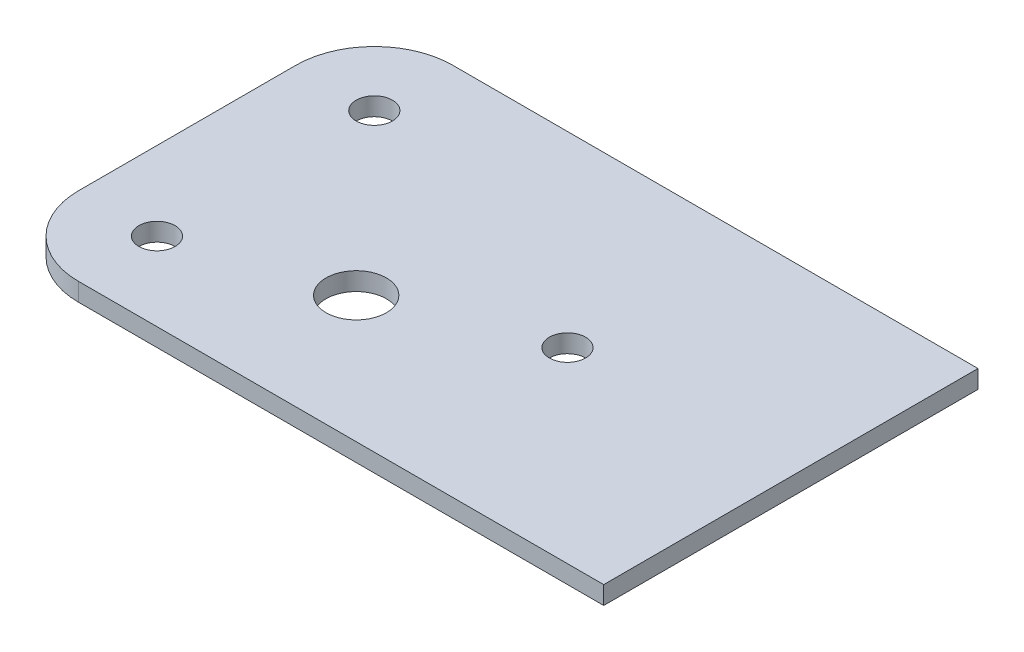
SolidWorks part; units mm, degrees
ref_plane "Front" through (0, 0, 0) normal (0, 0, 1) x (1, 0, 0)
ref_plane "Top" through (0, 0, 0) normal (0, 1, 0) x (1, 0, 0)
ref_plane "Right" through (0, 0, 0) normal (1, 0, 0) x (0, 0, -1)
sketch "Sketch1" plane through (0, 0, 0) normal (0, 1, 0) x (1, 0, 0)
  line L1 (13, 0) -> (100, 0)
  line L2 (0, 13) -> (0, 49)
  line L3 (13, 62) -> (100, 62)
  line L4 (100, 0) -> (100, 62)
  circle A0 centre (13, 49) radius 3
  circle A1 centre (13, 13) radius 3
  circle A2 centre (38, 21) radius 5
  circle A3 centre (63, 31) radius 3
  arc A4 (0, 49) -> (13, 62) centre (13, 49) cw
  arc A5 (13, 0) -> (0, 13) centre (13, 13) cw
  point P9 (0, 0)
extrude "Extrude1" add sketch "Sketch1" along normal blind 3
